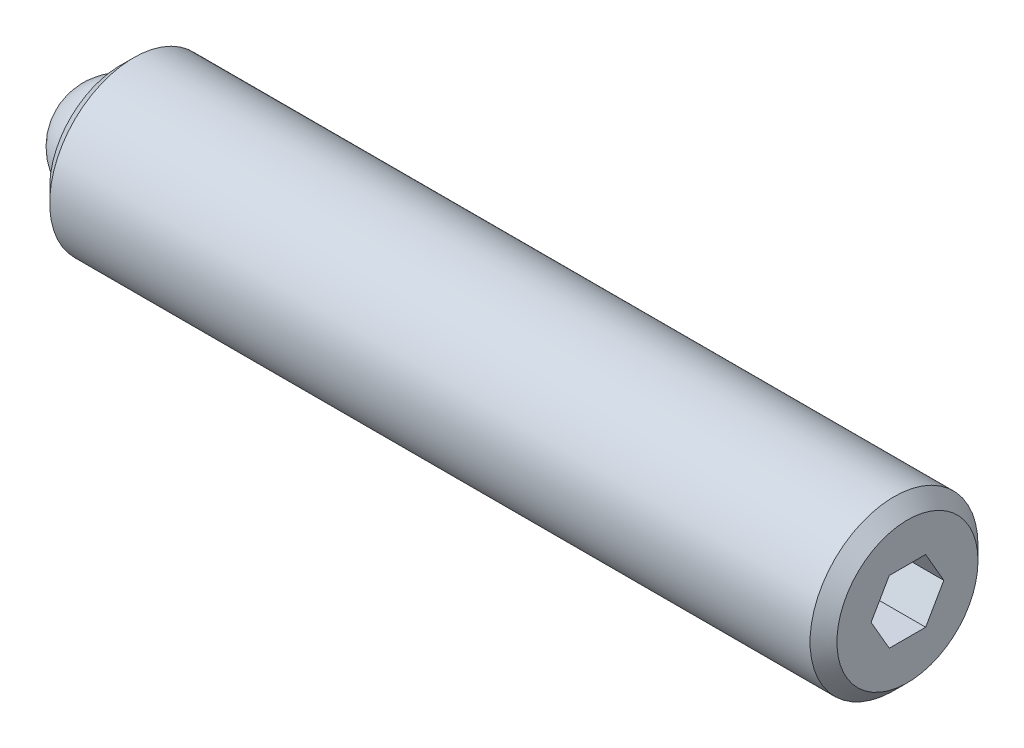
SolidWorks part; units mm, degrees
ref_plane "Front Plane" through (0, 0, 0) normal (0, 0, 1) x (1, 0, 0)
ref_plane "Top Plane" through (0, 0, 0) normal (0, 1, 0) x (1, 0, 0)
ref_plane "Right Plane" through (0, 0, 0) normal (1, 0, 0) x (0, 0, -1)
sketch "Sketch2" plane through (0, 0, 0) normal (1, 0, 0) x (0, 0, -1)
  circle A0 centre (0, 0) radius 3.175
  dimension "D1" = 6.35
extrude "Boss-Extrude1" add sketch "Sketch2" along normal blind 29.7656
sketch "Sketch3" plane through (0, 0, 0) normal (-1, 0, 0) x (0, 0, 1)
  circle A0 centre (0, 0) radius 1.9812
  dimension "D1" = 3.9624
chamfer "Chamfer1" distance 0.508 angle 45 1 edges at (0, 0, -3.175)
chamfer "Chamfer2" distance 0.508 angle 45 1 edges at (29.7656, 0, -3.175)
sketch "Sketch4" plane through (29.7656, 0, 0) normal (1, 0, 0) x (0, 0, -1)
  line L1 (1.3748, 0) -> (0.6874, 1.1906)
  line L2 (0.6874, 1.1906) -> (-0.6874, 1.1906)
  line L3 (-0.6874, 1.1906) -> (-1.3748, 0)
  line L4 (-1.3748, 0) -> (-0.6874, -1.1906)
  line L5 (-0.6874, -1.1906) -> (0.6874, -1.1906)
  line L6 (0.6874, -1.1906) -> (1.3748, 0)
  circle A0 centre (0, 0) radius 1.1906 construction
  dimension "D1" = 2.3813
extrude "Cut-Extrude2" cut sketch "Sketch4" against normal blind 2.286
extrude "Cut-Extrude3" cut sketch "Sketch3" against normal blind 1.9844
sketch "Sketch5" plane through (0, 0, 0) normal (-1, 0, 0) x (0, 0, 1)
  line L0 (0, 0) -> (0, -1.9844)
  line L1 (0, 0) -> (0, 1.9844)
  arc A0 (0, 1.9844) -> (0, -1.9844) centre (0, 0) ccw
  dimension "D1" = 1.9844
revolve "Revolve1" add sketch "Sketch5" angle 360 about L1
